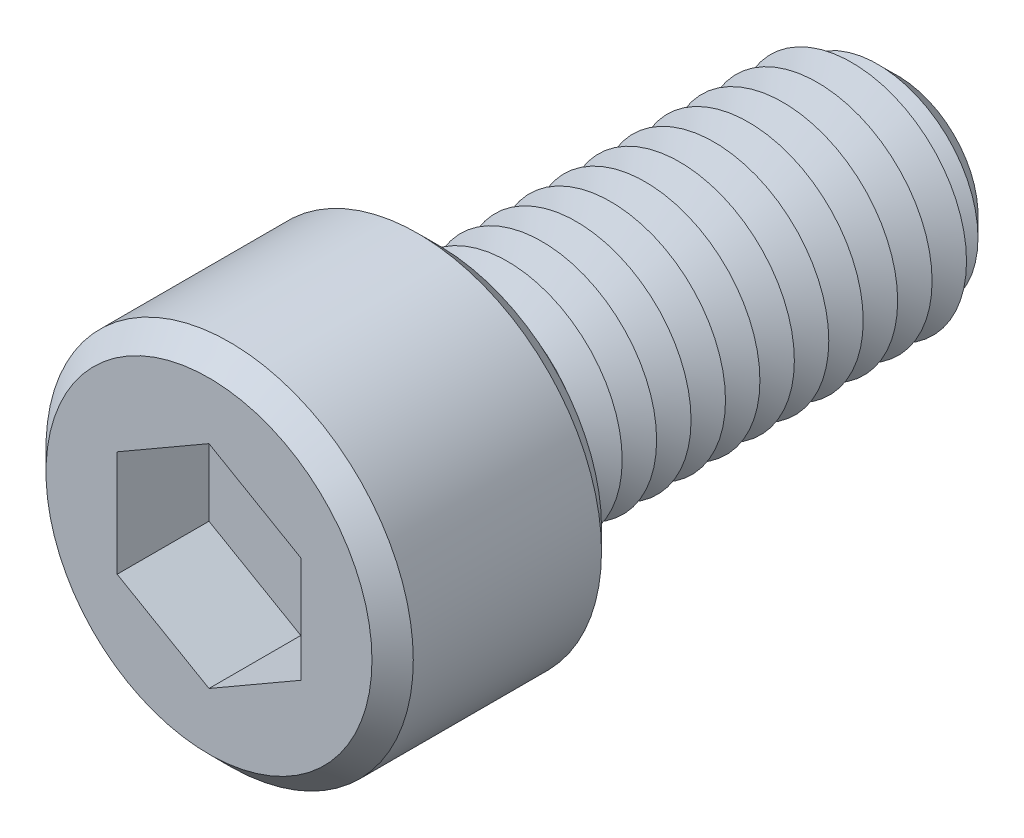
SolidWorks part; units mm, degrees
ref_plane "Front Plane" through (0, 0, 0) normal (0, 0, 1) x (1, 0, 0)
ref_plane "Top Plane" through (0, 0, 0) normal (0, 1, 0) x (1, 0, 0)
ref_plane "Right Plane" through (0, 0, 0) normal (1, 0, 0) x (0, 0, -1)
sketch "Sketch1" plane through (0, 0, 0) normal (0, 0, 1) x (1, 0, 0)
  circle A0 centre (0, 0) radius 8
  dimension "D1" = 16
extrude "Boss-Extrude1" add sketch "Sketch1" along normal blind 10
sketch "Sketch2" plane through (0, 0, 0) normal (0, 0, -1) x (-1, 0, 0)
  circle A0 centre (0, 0) radius 5
  dimension "D1" = 10
extrude "Boss-Extrude2" add sketch "Sketch2" along normal blind 20
chamfer "Chamfer1" distance 1.5 angle 45 1 edges at (-5, 0, -20)
sketch "Sketch3" plane through (0, 0, 0) normal (1, 0, 0) x (0, 0, -1)
  line L0 (-2.5121, 0) -> (4.5776, 0) construction
sketch "Sketch4" plane through (0, 0, 0) normal (1, 0, 0) x (0, 0, -1)
  line L0 (0, 5) -> (0.75, 3.701)
  line L1 (0.75, 3.701) -> (1.5, 5)
  line L2 (18.5, 5) -> (0, 5) construction
  line L3 (1.5, 5) -> (0, 5)
  dimension "D1" = 1.5
revolve "Cut-Revolve1" cut sketch "Sketch4" angle 360 about L0
pattern_linear "LPattern1" count 13 spacing 1.5 along (0, 0, -1) of "Cut-Revolve1"
sketch "Sketch5" plane through (0, 0, 10) normal (0, 0, 1) x (1, 0, 0)
  line L1 (0, 4.6188) -> (-4, 2.3094)
  line L2 (-4, 2.3094) -> (-4, -2.3094)
  line L3 (-4, -2.3094) -> (0, -4.6188)
  line L4 (0, -4.6188) -> (4, -2.3094)
  line L5 (4, -2.3094) -> (4, 2.3094)
  line L6 (4, 2.3094) -> (0, 4.6188)
  circle A0 centre (0, 0) radius 4 construction
  dimension "D1" = 8
extrude "Cut-Extrude1" cut sketch "Sketch5" against normal blind 4
sketch "Sketch6" plane through (0, 0, 6) normal (0, 0, 1) x (1, 0, 0)
  circle A0 centre (0, 0) radius 0.9
  dimension "D1" = 1.8
extrude "Cut-Extrude2" cut sketch "Sketch6" against normal up to surface (26 mm away)
chamfer "Chamfer2" distance 0.9 angle 45 2 edges at (8, 0, 0) (8, 0, 10)
